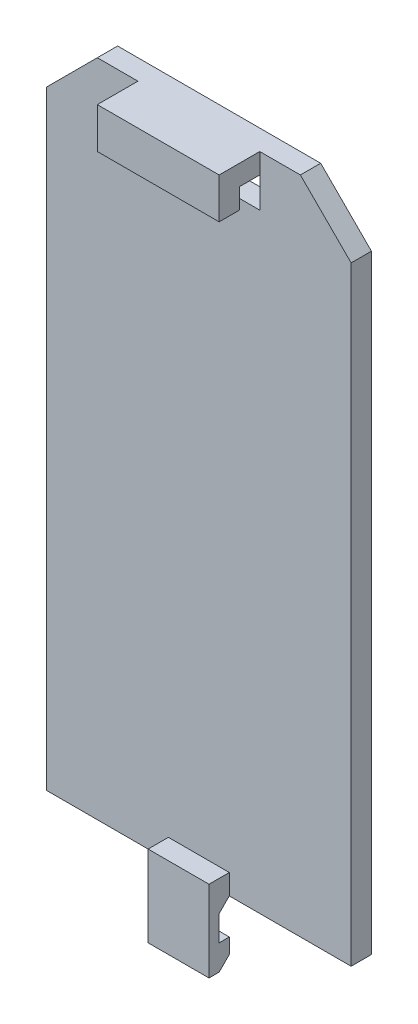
SolidWorks part; units mm, degrees
ref_plane "Face" through (0, 0, 0) normal (0, 0, 1) x (1, 0, 0)
ref_plane "Dessus" through (0, 0, 0) normal (0, 1, 0) x (1, 0, 0)
ref_plane "Droite" through (0, 0, 0) normal (1, 0, 0) x (0, 0, -1)
sketch "Esquisse1" plane through (0, 0, 0) normal (0, 0, 1) x (1, 0, 0)
  line L0 (-15, 60) -> (-10, 65)
  line L1 (-15, 0) -> (15, 0)
  line L2 (-15, 0) -> (-15, 60)
  line L3 (-10, 65) -> (10, 65)
  line L4 (15, 0) -> (15, 60)
  line L5 (10, 65) -> (15, 60)
  point P1 (15, 65)
  point P2 (-15, 65)
  dimension "D1" = 30
  dimension "D2" = 65
extrude "Extrusion1" add sketch "Esquisse1" along normal blind 2
sketch "Esquisse2" plane through (0, 0, 2) normal (0, 0, 1) x (1, 0, 0)
  line L0 (0, 76.5904) -> (0, -11.0657) construction
sketch "Esquisse3" plane through (0, 0, 2) normal (0, 0, 1) x (1, 0, 0)
  line L0 (10, 65) -> (-10, 65) construction
  line L1 (-6, 63) -> (6, 63)
  line L2 (-6, 63) -> (-6, 60)
  line L3 (-6, 60) -> (6, 60)
  line L4 (6, 63) -> (6, 60)
  line L5 (0, 76.5904) -> (0, -11.0657) construction
  dimension "D1" = 12
  dimension "D2" = 3
  dimension "D3" = 2
  dimension "D4" = 6
extrude "Enlèv. mat.-Extru.1" cut sketch "Esquisse3" against normal up to next
sketch "Esquisse4" plane through (0, 0, 0) normal (1, 0, 0) x (0, 0, -1)
  line L0 (-2, 63) -> (-4, 63)
  line L1 (-4, 63) -> (-4, 61)
  line L2 (-4, 61) -> (-6, 61)
  line L3 (-6, 61) -> (-6, 65)
  line L4 (-6, 65) -> (-2, 65)
  line L5 (-2, 65) -> (0, 65) construction
  line L6 (-2, 63) -> (-2, 65)
  dimension "D1" = 2
  dimension "D2" = 2
  dimension "D3" = 2
extrude "Extrusion2" add sketch "Esquisse4" along normal mid plane 12
sketch "Esquisse5" plane through (0, 0, 0) normal (1, 0, 0) x (0, 0, -1)
  line L0 (-2, 2) -> (-4, 2)
  line L1 (-2, 76.5904) -> (-2, -11.0657) construction
  line L2 (-4, 2) -> (-4, -6)
  line L3 (-4, -6) -> (-3, -6)
  line L4 (-3, -6) -> (-2, -5)
  line L5 (-2, -5) -> (-2, -3.5)
  line L6 (-2, -3.5) -> (-3, -3.5)
  line L7 (-3, -3.5) -> (-3, -1)
  line L8 (-3, -1) -> (-2, 0)
  line L9 (-2, 0) -> (0, 0) construction
  line L10 (-2, 0) -> (-2, 2)
  point P11 (-1, 0)
  dimension "D1" = 2
  dimension "D2" = 1
  dimension "D3" = 1
  dimension "D4" = 135
  dimension "D5" = 45
  dimension "D6" = 3.5
  dimension "D7" = 2
  dimension "D8" = 6
extrude "Extrusion3" add sketch "Esquisse5" along normal mid plane 6
sketch "Esquisse6" plane through (0, 0, 0) normal (1, 0, 0) x (0, 0, -1)
  line L0 (0, 5) -> (-1, 5)
  line L1 (0, 0) -> (0, 60) construction
  line L2 (-1, 5) -> (-1, 8)
  line L3 (-1, 8) -> (0, 8)
  line L4 (0, 8) -> (0, 5)
  line L5 (0, 8.2) -> (-1, 10)
  line L6 (-1, 10) -> (0, 10)
  line L7 (0, 10) -> (0, 8.2)
  line L8 (-2, 0) -> (0, 0) construction
  line L9 (0, 10.2) -> (-1, 12)
  line L10 (0, 12) -> (0, 10.2)
  line L11 (-1, 12) -> (0, 12)
  line L12 (0, 12.2) -> (-1, 14)
  line L13 (0, 14) -> (0, 12.2)
  line L14 (-1, 14) -> (0, 14)
  line L15 (0, 14.2) -> (-1, 16)
  line L16 (0, 16) -> (0, 14.2)
  line L17 (-1, 16) -> (0, 16)
  dimension "D1" = 5
  dimension "D2" = 3
  dimension "D3" = 1
  dimension "D4" = 2
  dimension "D5" = 0.2
extrude "Enlèv. mat.-Extru.2" cut sketch "Esquisse6" against normal mid plane 16
